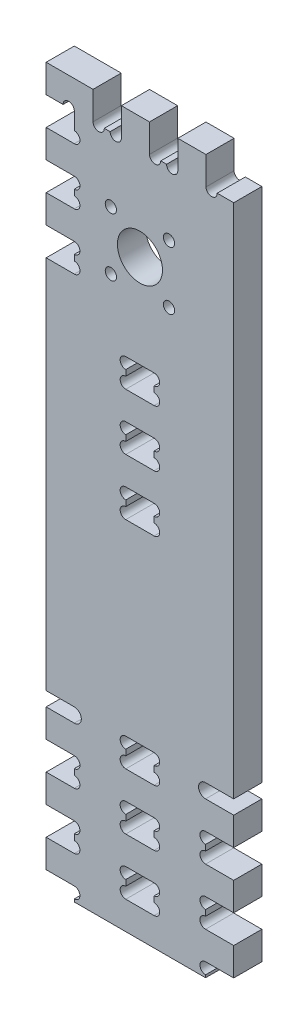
SolidWorks part; units mm, degrees
ref_plane "Ebene vorne" through (0, 0, 0) normal (0, 0, 1) x (1, 0, 0)
ref_plane "Ebene oben" through (0, 0, 0) normal (0, 1, 0) x (1, 0, 0)
ref_plane "Ebene rechts" through (0, 0, 0) normal (1, 0, 0) x (0, 0, -1)
sketch "Skizze1" plane through (0, 0, 0) normal (0, 0, 1) x (1, 0, 0)
  line L0 (0, 82.6) -> (15, 82.6)
  line L1 (0, 365.2705) -> (9, 365.2705)
  line L5 (0, 82.6) -> (0, 67.6)
  line L6 (0, 67.6) -> (15, 67.6)
  line L7 (15, 61.6) -> (15, 58.5)
  line L8 (15, 52.5) -> (0, 52.5)
  line L9 (0, 52.5) -> (0, 37.5)
  line L10 (0, 37.5) -> (15, 37.5)
  line L11 (15, 31.5) -> (15, 28.4)
  line L13 (0, 22.4) -> (0, 7.4)
  line L14 (15, 22.4) -> (0, 22.4)
  line L15 (0, 7.4) -> (15, 7.4)
  line L16 (85, 90.1) -> (100, 90.1)
  line L17 (85, 82.6) -> (100, 82.6)
  line L18 (100, 67.6) -> (85, 67.6)
  line L19 (85, 61.6) -> (85, 58.5)
  line L20 (85, 52.5) -> (100, 52.5)
  line L21 (100, 52.5) -> (100, 37.5)
  line L22 (100, 37.5) -> (85, 37.5)
  line L23 (85, 31.5) -> (85, 28.4)
  line L24 (100, 82.6) -> (100, 67.6)
  line L25 (85, 22.4) -> (100, 22.4)
  line L26 (100, 7.4) -> (85, 7.4)
  line L27 (100, 22.4) -> (100, 7.4)
  line L29 (15, 1.4) -> (15, 0)
  line L30 (85, 1.4) -> (85, 0)
  line L31 (85, 0) -> (15, 0)
  line L32 (0, 289.9705) -> (0, 90.1)
  line L33 (0, 90.1) -> (15, 90.1)
  line L34 (100, 90.1) -> (100, 365.4)
  line L35 (15, 295.9705) -> (15, 299.0705)
  line L36 (15, 350.1705) -> (0, 350.1705)
  line L37 (0, 305.0705) -> (0, 320.0705)
  line L39 (15, 326.0705) -> (15, 329.1705)
  line L40 (0, 335.1705) -> (15, 335.1705)
  line L41 (0, 335.1705) -> (0, 350.1705)
  line L42 (15, 320.0705) -> (0, 320.0705)
  line L43 (15, 356.1705) -> (15, 365.2705)
  line L44 (0, 305.0705) -> (15, 305.0705)
  line L45 (0, 365.2705) -> (0, 380.2705)
  line L46 (0, 380.2705) -> (25, 380.2705)
  line L47 (31, 365.2705) -> (34.1, 365.2705)
  line L48 (40.1, 365.2705) -> (40.1, 380.2705)
  line L49 (55.1, 380.2705) -> (55.1, 365.2705)
  line L50 (40.1, 380.2705) -> (55.1, 380.2705)
  line L51 (61.1, 365.2705) -> (64.2, 365.2705)
  line L52 (70.2, 365.2705) -> (70.2, 380.2705)
  line L53 (85.2, 380.2705) -> (85.2, 365.2705)
  line L54 (70.2, 380.2705) -> (85.2, 380.2705)
  line L55 (91.2, 365.4) -> (100, 365.4)
  line L56 (25, 365.2705) -> (25, 380.2705)
  line L57 (15, 289.9705) -> (0, 289.9705)
  arc A0 (15, 67.6) -> (15, 61.6) centre (15, 64.6) cw
  arc A1 (15, 58.5) -> (15, 52.5) centre (15, 55.5) cw
  arc A2 (15, 37.5) -> (15, 31.5) centre (15, 34.5) cw
  arc A3 (15, 28.4) -> (15, 22.4) centre (15, 25.4) cw
  arc A4 (15, 7.4) -> (15, 1.4) centre (15, 4.4) cw
  arc A5 (85, 7.4) -> (85, 1.4) centre (85, 4.4) ccw
  arc A6 (85, 22.4) -> (85, 28.4) centre (85, 25.4) cw
  arc A7 (85, 31.5) -> (85, 37.5) centre (85, 34.5) cw
  arc A8 (85, 52.5) -> (85, 58.5) centre (85, 55.5) cw
  arc A9 (85, 61.6) -> (85, 67.6) centre (85, 64.6) cw
  arc A10 (15, 82.6) -> (15, 90.1) centre (15, 86.35) ccw
  arc A11 (85, 82.6) -> (85, 90.1) centre (85, 86.35) cw
  arc A12 (15, 365.2705) -> (9, 365.2705) centre (12, 365.2705) ccw
  arc A13 (15, 356.1705) -> (15, 350.1705) centre (15, 353.1705) cw
  arc A14 (15, 335.1705) -> (15, 329.1705) centre (15, 332.1705) cw
  arc A15 (15, 326.0705) -> (15, 320.0705) centre (15, 323.0705) cw
  arc A16 (15, 305.0705) -> (15, 299.0705) centre (15, 302.0705) cw
  arc A17 (15, 295.9705) -> (15, 289.9705) centre (15, 292.9705) cw
  arc A18 (91.2, 365.4) -> (85.2, 365.2705) centre (88.2, 365.3353) cw
  arc A19 (70.2, 365.2705) -> (64.2, 365.2705) centre (67.2, 365.2705) cw
  arc A20 (61.1, 365.2705) -> (55.1, 365.2705) centre (58.1, 365.2705) cw
  arc A21 (40.1, 365.2705) -> (34.1, 365.2705) centre (37.1, 365.2705) cw
  arc A22 (31, 365.2705) -> (25, 365.2705) centre (28, 365.2705) cw
  dimension "D13" = 15.1
  dimension "D14" = 100
  dimension "D15" = 7.5
  dimension "D16" = 15
  dimension "D17" = 290.1705
  dimension "D18" = 15.1
  dimension "D12" = 15.1
  dimension "D19" = 7.5
  dimension "D20" = 15
  dimension "D21" = 15
  dimension "D22" = 15
  dimension "D23" = 15.1
  dimension "D36" = 6
  dimension "D37" = 6
  dimension "D38" = 6
  dimension "D39" = 3.1
  dimension "D40" = 6
  dimension "D41" = 6
  dimension "D6" = 15
  dimension "D7" = 15.1
  dimension "D8" = 15.1
  dimension "D9" = 15
  dimension "D10" = 7.4
  dimension "D11" = 15
  dimension "D24" = 9
  dimension "D25" = 9.1
  dimension "D26" = 15
  dimension "D27" = 15
  dimension "D28" = 3.1
  dimension "D29" = 15
  dimension "D30" = 15
  dimension "D31" = 15
  dimension "D32" = 6
  dimension "D33" = 100
  dimension "D34" = 6
  dimension "D35" = 15
  dimension "D47" = 15
  dimension "D49" = 15
  dimension "D50" = 15
  dimension "D51" = 15
  dimension "D52" = 15
  dimension "D53" = 6
  dimension "D54" = 15
  dimension "D55" = 6
  dimension "D56" = 15
  dimension "D57" = 15
  dimension "D58" = 15
  dimension "D59" = 6
  dimension "D60" = 15.1
  dimension "D61" = 15.1
  dimension "D62" = 7.4
  dimension "D63" = 15
  dimension "D64" = 15
  dimension "D65" = 15
  dimension "D66" = 6
  dimension "D67" = 6
  dimension "D68" = 6
  dimension "D69" = 6
  dimension "D70" = 6
  dimension "D71" = 6
  dimension "D72" = 6
  dimension "D73" = 15
extrude "Aufsatz-Linear austragen1" add sketch "Skizze1" along normal blind 15
sketch "Skizze2" plane through (0, 0, 0) normal (0, 0, -1) x (-1, 0, 0)
  line L0 (-100, 90.1) -> (-100, 365.4) construction
  line L1 (-61.1, 365.2705) -> (-64.2, 365.2705) construction
  circle A0 centre (-50, 350.2705) radius 5.05
  circle A1 centre (-50, 280.2705) radius 5.05
  dimension "D1" = 10.1
  dimension "D2" = 10.1
  dimension "D3" = 50
  dimension "D4" = 70
  dimension "D5" = 15
extrude "Schnitt-Linear austragen2" cut sketch "Skizze2" against normal blind 7.5
sketch "Skizze3" plane through (0, 0, 0) normal (0, 0, -1) x (-1, 0, 0)
  line L0 (-100, 90.1) -> (-100, 365.4) construction
  circle A0 centre (-50, 315.2705) radius 12
  circle A1 centre (-50, 350.2705) radius 5.05 construction
  circle A3 centre (-65.5, 330.7705) radius 3
  circle A4 centre (-34.5, 330.7705) radius 3
  circle A5 centre (-34.5, 299.7705) radius 3
  circle A6 centre (-65.5, 299.7705) radius 3
  dimension "D1" = 35
  dimension "D2" = 24
  dimension "D3" = 50
  dimension "D4" = 6
  dimension "D5" = 6
  dimension "D6" = 6
  dimension "D7" = 6
  dimension "D8" = 31
  dimension "D9" = 31
  dimension "D10" = 31
  dimension "D11" = 15.5
  dimension "D12" = 15.5
extrude "Schnitt-Linear austragen3" cut sketch "Skizze3" against normal blind 17.5
sketch "Skizze5" plane through (0, 0, 15) normal (0, 0, 1) x (1, 0, 0)
  line L0 (42.45, 45.1) -> (57.55, 45.1)
  line L1 (57.55, 51.1) -> (57.55, 54.2)
  line L2 (42.45, 15) -> (57.55, 15)
  line L3 (57.55, 21) -> (57.55, 24.1)
  line L4 (0, 22.4) -> (0, 7.4) construction
  line L5 (85, 0) -> (15, 0) construction
  line L6 (85, 31.5) -> (85, 28.4) construction
  line L7 (15, 31.5) -> (15, 28.4) construction
  line L8 (42.45, 24.1) -> (42.45, 21)
  line L9 (42.45, 30.1) -> (57.55, 30.1)
  line L10 (15, 0) -> (85, 0) construction
  line L11 (42.45, 54.2) -> (42.45, 51.1)
  line L12 (42.45, 60.2) -> (57.55, 60.2)
  line L13 (42.45, 75.2) -> (57.55, 75.2)
  line L14 (57.55, 81.2) -> (57.55, 84.3)
  line L15 (42.45, 84.3) -> (42.45, 81.2)
  line L16 (42.45, 90.3) -> (57.55, 90.3)
  line L17 (42.45, 220.4) -> (57.55, 220.4)
  line L18 (57.55, 226.4) -> (57.55, 229.5)
  line L19 (42.45, 190.3) -> (57.55, 190.3)
  line L20 (57.55, 196.3) -> (57.55, 199.4)
  line L21 (42.45, 199.4) -> (42.45, 196.3)
  line L22 (42.45, 205.4) -> (57.55, 205.4)
  line L23 (42.45, 229.5) -> (42.45, 226.4)
  line L24 (42.45, 235.5) -> (57.55, 235.5)
  line L25 (42.45, 250.5) -> (57.55, 250.5)
  line L26 (57.55, 256.5) -> (57.55, 259.6)
  line L27 (42.45, 259.6) -> (42.45, 256.5)
  line L28 (42.45, 265.6) -> (57.55, 265.6)
  arc A0 (57.55, 30.1) -> (57.55, 24.1) centre (57.55, 27.1) cw
  arc A1 (57.55, 21) -> (57.55, 15) centre (57.55, 18) cw
  arc A2 (42.45, 21) -> (42.45, 15) centre (42.45, 18) ccw
  arc A3 (42.45, 24.1) -> (42.45, 30.1) centre (42.45, 27.1) cw
  arc A4 (57.55, 60.2) -> (57.55, 54.2) centre (57.55, 57.2) cw
  arc A5 (57.55, 51.1) -> (57.55, 45.1) centre (57.55, 48.1) cw
  arc A6 (42.45, 51.1) -> (42.45, 45.1) centre (42.45, 48.1) ccw
  arc A7 (42.45, 54.2) -> (42.45, 60.2) centre (42.45, 57.2) cw
  arc A8 (57.55, 90.3) -> (57.55, 84.3) centre (57.55, 87.3) cw
  arc A9 (57.55, 81.2) -> (57.55, 75.2) centre (57.55, 78.2) cw
  arc A10 (42.45, 81.2) -> (42.45, 75.2) centre (42.45, 78.2) ccw
  arc A11 (42.45, 84.3) -> (42.45, 90.3) centre (42.45, 87.3) cw
  arc A12 (57.55, 205.4) -> (57.55, 199.4) centre (57.55, 202.4) cw
  arc A13 (57.55, 196.3) -> (57.55, 190.3) centre (57.55, 193.3) cw
  arc A14 (42.45, 196.3) -> (42.45, 190.3) centre (42.45, 193.3) ccw
  arc A15 (42.45, 199.4) -> (42.45, 205.4) centre (42.45, 202.4) cw
  arc A16 (57.55, 235.5) -> (57.55, 229.5) centre (57.55, 232.5) cw
  arc A17 (57.55, 226.4) -> (57.55, 220.4) centre (57.55, 223.4) cw
  arc A18 (42.45, 226.4) -> (42.45, 220.4) centre (42.45, 223.4) ccw
  arc A19 (42.45, 229.5) -> (42.45, 235.5) centre (42.45, 232.5) cw
  arc A20 (57.55, 265.6) -> (57.55, 259.6) centre (57.55, 262.6) cw
  arc A21 (57.55, 256.5) -> (57.55, 250.5) centre (57.55, 253.5) cw
  arc A22 (42.45, 256.5) -> (42.45, 250.5) centre (42.45, 253.5) ccw
  arc A23 (42.45, 259.6) -> (42.45, 265.6) centre (42.45, 262.6) cw
  dimension "D2" = 27.45
  dimension "D3" = 27.45
  dimension "D4" = 15.1
  dimension "D9" = 15.1
  dimension "D10" = 15.1
  dimension "D11" = 15.1
  dimension "D19" = 3.1
  dimension "D20" = 6
  dimension "D14" = 3.1
  dimension "D16" = 15.1
  dimension "D17" = 0
  dimension "D22" = 15.1
  dimension "D24" = 15.1
  dimension "D29" = 6
  dimension "D30" = 15.1
  dimension "D35" = 0
  dimension "D37" = 3.1
  dimension "D41" = 15.1
  dimension "D46" = 6
  dimension "D50" = 15.1
  dimension "D55" = 6
  dimension "D60" = 100
  dimension "D5" = 15
  dimension "D6" = 15.1
  dimension "D8" = 15.1
  dimension "D12" = 0
  dimension "D13" = 15.1
  dimension "D15" = 3.1
  dimension "D18" = 3.1
  dimension "D21" = 6
  dimension "D23" = 15.1
  dimension "D25" = 0
  dimension "D26" = 3.1
  dimension "D27" = 3.1
  dimension "D28" = 6
  dimension "D31" = 15.1
  dimension "D32" = 15
  dimension "D33" = 15
  dimension "D34" = 15.1
  dimension "D36" = 3.1
  dimension "D38" = 6
  dimension "D39" = 6
  dimension "D40" = 15.1
  dimension "D42" = 15.1
  dimension "D43" = 0
  dimension "D44" = 3.1
  dimension "D45" = 3.1
  dimension "D47" = 6
  dimension "D48" = 15.1
  dimension "D49" = 15.1
  dimension "D51" = 0
  dimension "D52" = 3.1
  dimension "D53" = 3.1
  dimension "D54" = 6
  dimension "D56" = 15.1
  dimension "D57" = 15.1
  dimension "D58" = 15
  dimension "D59" = 15
  dimension "D70" = 6
  dimension "D72" = 6
extrude "Schnitt-Linear austragen5" cut sketch "Skizze5" against normal blind 17.5
